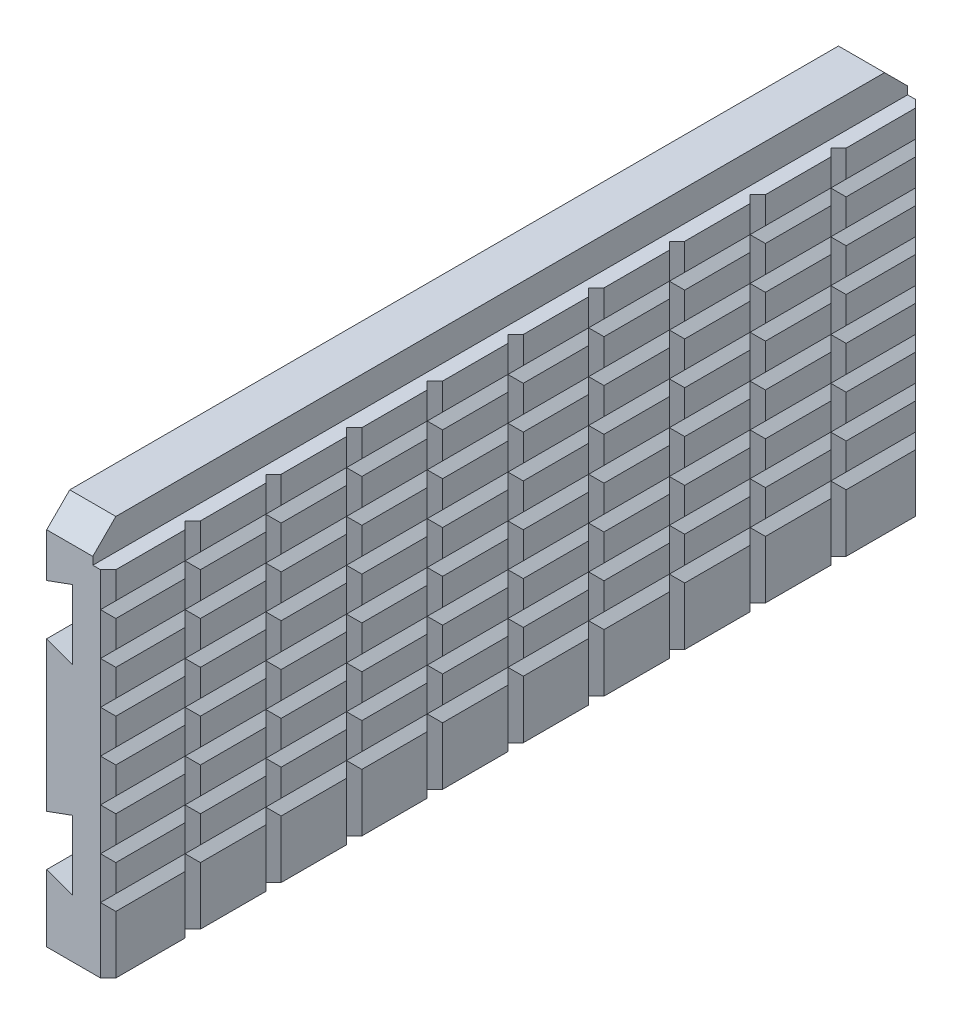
SolidWorks part; units mm, degrees
ref_plane "Спереди" through (0, 0, 0) normal (0, 0, 1) x (1, 0, 0)
ref_plane "Сверху" through (0, 0, 0) normal (0, 1, 0) x (1, 0, 0)
ref_plane "Справа" through (0, 0, 0) normal (1, 0, 0) x (0, 0, -1)
sketch "Эскиз1" plane through (0, 0, 53) normal (0, 0, 1) x (1, 0, 0)
  line L0 (-67.5, 50) -> (-59.5, 50)
  line L1 (-59.5, 50) -> (-59.5, 0)
  line L2 (-59.5, 0) -> (-67.5, 0)
  line L3 (-67.5, 50) -> (-67.5, 41.2806)
  line L16 (-67.5, 34.7194) -> (-67.5, 15.2806)
  line L18 (-67.5, 8.7194) -> (-67.5, 0)
  line L20 (-67.6197, 34.763) -> (-64.15, 33.5001)
  line L21 (-64.15, 33.5001) -> (-64.15, 42.4999)
  line L22 (-64.15, 42.4999) -> (-67.6197, 41.237)
  line L23 (-67.5, 34.7194) -> (-64.15, 33.5001)
  line L24 (-64.15, 33.5001) -> (-64.15, 42.4999)
  line L25 (-64.15, 42.4999) -> (-67.5, 41.2806)
  line L29 (-64.15, 16.4999) -> (-67.6197, 15.237)
  line L30 (-64.15, 7.5001) -> (-64.15, 16.4999)
  line L31 (-67.6197, 8.763) -> (-64.15, 7.5001)
  line L32 (-64.15, 16.4999) -> (-67.5, 15.2806)
  line L33 (-64.15, 7.5001) -> (-64.15, 16.4999)
  line L34 (-67.5, 8.7194) -> (-64.15, 7.5001)
  line L80 (-82.5, 50) -> (-67.5, 50) construction
  line L81 (-67.5, 40.9081) -> (-67.5, 47) construction
  dimension "D1" = 8
  dimension "D2" = 0.35
  dimension "D3" = 0.35
extrude "Бобышка-Вытянуть1" add sketch "Эскиз1" against normal up to surface (106 mm away)
sketch "Эскиз3" plane through (0, 0, 53) normal (0, 0, 1) x (1, 0, 0)
  line L1 (-59.5, 50) -> (-61.5, 50)
  line L2 (-59.5, 50) -> (-59.5, 46)
  line L3 (-59.5, 46) -> (-61.5, 46)
  line L4 (-61.5, 50) -> (-61.5, 46)
  dimension "D1" = 2
  dimension "D2" = 4
extrude "Вырез-Вытянуть1" cut sketch "Эскиз3" against normal through all
sketch "Эскиз4" plane through (0, 0, 53) normal (0, 0, 1) x (1, 0, 0)
  line L0 (-67.5, 25) -> (-52.2964, 25) construction
  line L1 (-67.5, 34.7194) -> (-67.5, 15.2806) construction
  line L2 (-59.5, 24) -> (-60.5, 25)
  line L3 (-59.5, 0) -> (-59.5, 46) construction
  line L4 (-59.5, 26) -> (-60.5, 25)
  line L5 (-59.5, 26) -> (-59.5, 24)
  dimension "D1" = 90
  dimension "D2" = 1
extrude "Вырез-Вытянуть2" cut sketch "Эскиз4" against normal through all
pattern_linear "Линейный массив1" count 4 spacing 5.5 along (0, 1, 0) count 4 spacing 5.5 along (0, -1, 0) of "Вырез-Вытянуть2"
sketch "Эскиз5" plane through (0, 50, 0) normal (0, 1, 0) x (1, 0, 0)
  line L0 (0, 0) -> (-59.5, 0) construction
  line L1 (-59.5, 1) -> (-59.5, -1)
  line L2 (-59.5, 1) -> (-60.5, 0)
  line L3 (-59.5, -1) -> (-60.5, 0)
  line L4 (-59.5, 53) -> (-59.5, -53) construction
  dimension "D1" = 90
  dimension "D2" = 1
extrude "Вырез-Вытянуть3" cut sketch "Эскиз5" against normal through all
pattern_linear "Линейный массив2" count 5 spacing 10.5 along (0, 0, -1) count 5 spacing 10.5 along (0, 0, 1) of "Вырез-Вытянуть3"
chamfer "Фаска1" distance 1 angle 45 16 edges at (-59.5, 3.75, -53) (-59.5, 11.25, -53) (-59.5, 16.75, -53) (-59.5, 22.25, -53) (-59.5, 27.75, -53) (-59.5, 33.25, -53) (-59.5, 38.75, -53) (-59.5, 44.25, -53) (-59.5, 3.75, 53) (-59.5, 11.25, 53) (-59.5, 16.75, 53) (-59.5, 22.25, 53) (-59.5, 27.75, 53) (-59.5, 33.25, 53) (-59.5, 38.75, 53) (-59.5, 44.25, 53)
chamfer "Фаска2" distance 3 angle 45 2 edges at (-64.5, 50, -53) (-64.5, 50, 53)
